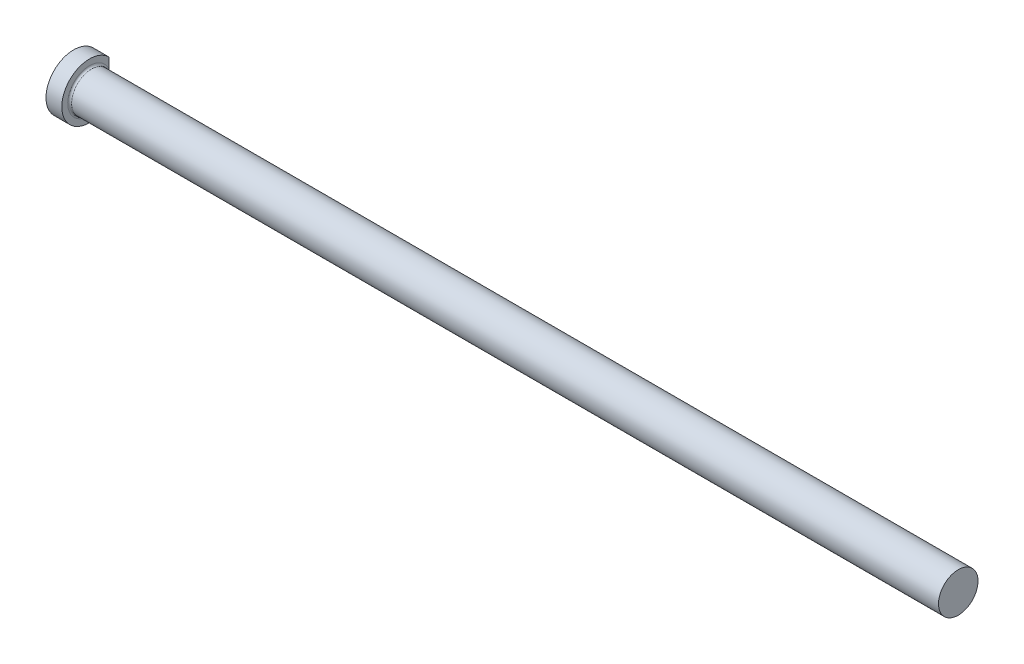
SolidWorks part; units mm, degrees
ref_plane "Front Plane" through (0, 0, 0) normal (0, 0, 1) x (1, 0, 0)
ref_plane "Top Plane" through (0, 0, 0) normal (0, 1, 0) x (1, 0, 0)
ref_plane "Right Plane" through (0, 0, 0) normal (1, 0, 0) x (0, 0, -1)
sketch "Sketch1" plane through (0, 0, 0) normal (0, 0, 1) x (1, 0, 0)
  line L0 (0, 0) -> (0, 11.1125)
  line L1 (0, 11.1125) -> (6.35, 11.1125)
  line L2 (6.35, 11.1125) -> (6.35, 8.7249)
  line L3 (7.1374, 7.9375) -> (355.6, 7.9375)
  line L4 (355.6, 7.9375) -> (355.6, 0)
  line L5 (355.6, 0) -> (0, 0)
  line L6 (355.6, 0) -> (0, 0) construction
  line L7 (0, 0) -> (-10.4771, 0) construction
  line L8 (355.6, 0) -> (1002.3976, 0) construction
  line L9 (7.1374, 7.9375) -> (-7.9138, 7.9375) construction
  arc A0 (7.1374, 7.9375) -> (6.35, 8.7249) centre (7.1374, 8.7249) cw
  dimension "D1" = 0.7874
  dimension "HeadDia" = 22.225
  dimension "HeadThickness" = 6.35
  dimension "PinDia" = 15.875
  dimension "overall" = 355.6
revolve "PIN" add sketch "Sketch1" angle 360 about L6
ref_plane "Plane1" through (181.3687, 0, -7.9375) normal (0, 0, -1) x (0, -1, 0)
ref_plane "CutPlane" through (0, 0, -7.9378) normal (0, 0, -1) x (-1, 0, 0)
other "SurfaceCut1"
